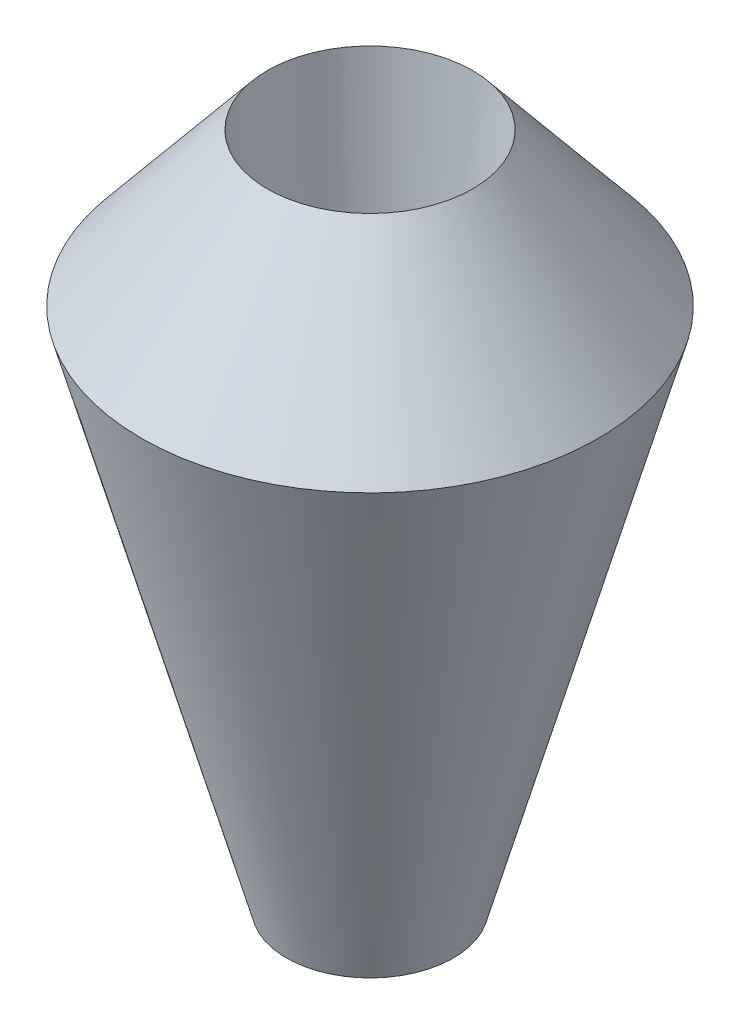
SolidWorks part; units mm, degrees
ref_plane "Front" through (0, 0, 0) normal (0, 0, 1) x (1, 0, 0)
ref_plane "Top" through (0, 0, 0) normal (0, 1, 0) x (1, 0, 0)
ref_plane "Right" through (0, 0, 0) normal (1, 0, 0) x (0, 0, -1)
sketch "Sketch1" plane through (0, 0, 0) normal (0, 0, 1) x (1, 0, 0)
  line L0 (0, 0) -> (0, 100) construction
  line L1 (11.3512, 0) -> (31.088, 71.0778)
  line L2 (31.088, 71.0778) -> (13.9563, 91.8668)
  line L3 (13.9563, 91.8668) -> (6.6179, 0)
  line L4 (6.6179, 0) -> (11.3512, 0)
  dimension "D1" = 100
revolve "Revolve1" add sketch "Sketch1" angle 360 about L0
